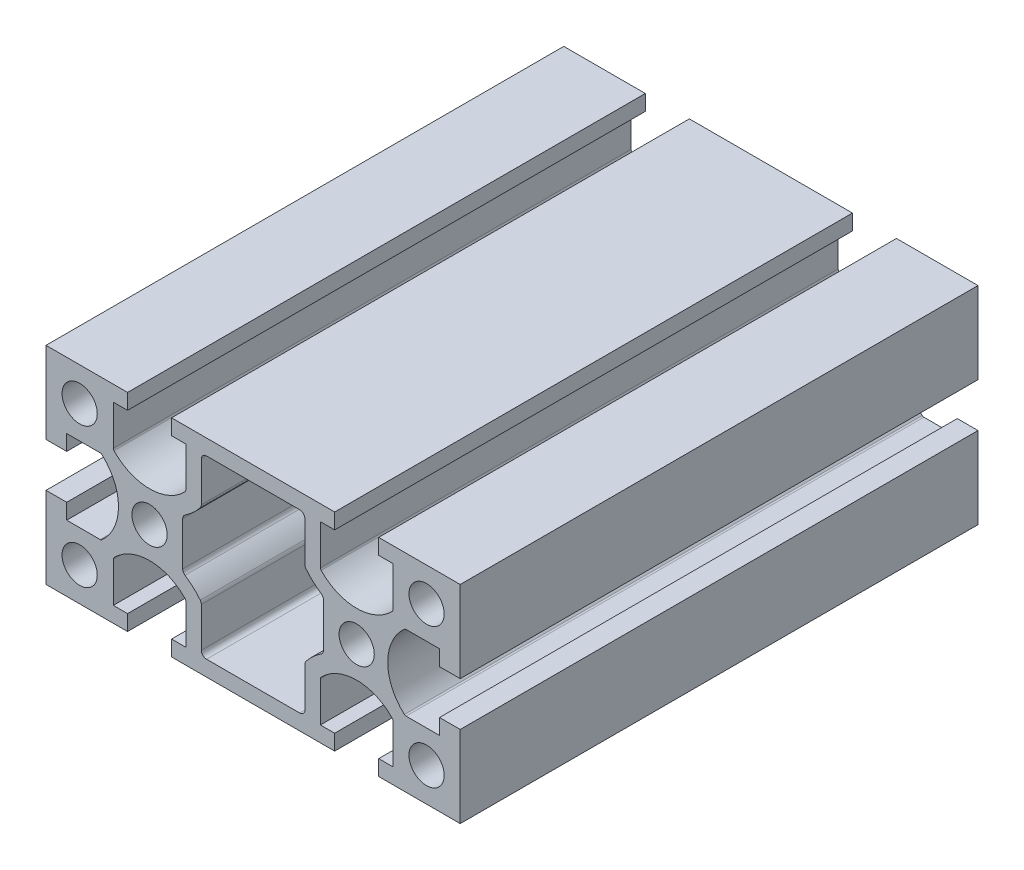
SolidWorks part; units mm, degrees
ref_plane "前基準面" through (0, 0, 0) normal (0, 0, 1) x (1, 0, 0)
ref_plane "上基準面" through (0, 0, 0) normal (0, 1, 0) x (1, 0, 0)
ref_plane "右基準面" through (0, 0, 0) normal (1, 0, 0) x (0, 0, -1)
sketch "草圖1" plane through (0, 0, 0) normal (0, 0, 1) x (1, 0, 0)
  line L0 (0, 53.2301) -> (0, -51.0629) construction
  line L2 (-40, 20) -> (40, 20)
  line L3 (-40, 20) -> (-40, -20)
  line L4 (-40, -20) -> (40, -20)
  line L5 (40, 20) -> (40, -20)
  line L6 (-40, 20) -> (40, -20) construction
  line L7 (-40, -20) -> (40, 20) construction
  point P3 (0, 0)
  dimension "D1" = 80
  dimension "D2" = 40
extrude "填料-伸長1" add sketch "草圖1" along normal mid plane 100
sketch "草圖2" plane through (0, 0, 50) normal (0, 0, 1) x (1, 0, 0)
  circle A0 centre (-20, 0) radius 3.4
  circle A1 centre (20, 0) radius 3.4
  dimension "D1" = 40
  dimension "D3" = 6.8
  dimension "D2" = 20
extrude "除料-伸長1" cut sketch "草圖2" against normal through all
sketch "草圖3" plane through (0, 0, 50) normal (0, 0, 1) x (1, 0, 0)
  line L0 (-33.5, 13.5) -> (33.5, 13.5) construction
  circle A0 centre (-33.5, 13.5) radius 3.4
  circle A2 centre (33.5, 13.5) radius 3.4
  circle A3 centre (33.5, -13.5) radius 3.4
  circle A4 centre (-33.5, -13.5) radius 3.4
  dimension "D2" = 6.8
  dimension "D1" = 33.5
  dimension "D3" = 13.5
  dimension "D5" = 67
  dimension "D4" = 2
extrude "除料-伸長2" cut sketch "草圖3" against normal through all
sketch "草圖4" plane through (0, 0, 50) normal (0, 0, 1) x (1, 0, 0)
  line L0 (20, 20) -> (20, 10) construction
  line L1 (40, 20) -> (-40, 20) construction
  line L2 (40, 20) -> (20, 20) construction
  line L3 (15.75, 20) -> (24.25, 20)
  line L4 (13, 17) -> (13, 9.2751)
  line L5 (15.75, 17) -> (13, 17)
  line L6 (15.75, 20) -> (15.75, 17)
  line L10 (24.25, 20) -> (24.25, 17)
  line L11 (27, 17) -> (27, 9.2751)
  line L15 (24.25, 17) -> (27, 17)
  arc A0 (26.8611, 8.9292) -> (27, 9.2751) centre (26.5, 9.2751) ccw
  arc A1 (13, 9.2751) -> (13.1389, 8.9292) centre (13.5, 9.2751) ccw
  arc A3 (13.1389, 8.9292) -> (26.8611, 8.9292) centre (20, 15.5) ccw
  point P10 (27, 9.0774)
  point P14 (13, 9.0774)
  dimension "D1" = 20
  dimension "D6" = 9.5
  dimension "D4" = 8.5
  dimension "D5" = 3
  dimension "D7" = 4.5
  dimension "D2" = 0.5
  dimension "D3" = 14
extrude "除料-伸長3" cut sketch "草圖4" against normal through all
mirror "鏡射1" about plane through (0, 0, 0) normal (0, 1, 0) of "除料-伸長3"
pattern_linear "直線複製排列1" count 2 spacing 40 along (-1, 0, 0) of "鏡射1", "除料-伸長3"
sketch "草圖5" plane through (0, 0, 50) normal (0, 0, 1) x (1, 0, 0)
  line L0 (0, 0) -> (-40, 0) construction
  line L1 (-40, 20) -> (-40, -20) construction
  line L2 (-40, -4.25) -> (-40, 4.25)
  line L3 (-40, 4.25) -> (-36, 4.25)
  line L4 (-36, 4.25) -> (-36, 7.25)
  line L5 (-36, 7.25) -> (-29.5471, 7.25)
  line L6 (-40, -4.25) -> (-36, -4.25)
  line L7 (-36, -4.25) -> (-36, -7.25)
  line L8 (-36, -7.25) -> (-29.5471, -7.25)
  arc A0 (-29.2163, -7.125) -> (-29.2163, 7.125) centre (-35.5, 0) ccw
  arc A1 (-29.5471, 7.25) -> (-29.2163, 7.125) centre (-29.5471, 6.75) cw
  arc A2 (-29.5471, -7.25) -> (-29.2163, -7.125) centre (-29.5471, -6.75) ccw
  dimension "D4" = 9.5
  dimension "D5" = 0.5
  dimension "D1" = 4
  dimension "D2" = 8.5
  dimension "D3" = 14.5
  dimension "D6" = 4.5
extrude "除料-伸長4" cut sketch "草圖5" against normal through all
mirror "鏡射2" about plane through (0, 0, 0) normal (1, 0, 0) of "除料-伸長4"
sketch "草圖7" plane through (0, 0, 50) normal (0, 0, 1) x (1, 0, 0)
  line L0 (-9, 17) -> (9, 17)
  line L1 (10, 16) -> (10, 8.3411)
  line L2 (-13.6, 0) -> (13.6, 0) construction
  line L3 (13.6, 4.2089) -> (13.6, -4.2089)
  line L4 (0, -17) -> (0, 17) construction
  line L5 (15.75, 17) -> (13, 17) construction
  line L6 (13, 17) -> (13, 9.2751) construction
  line L7 (-13.6, 4.2089) -> (-13.6, -4.2089)
  line L8 (-10, 16) -> (-10, 8.3411)
  line L9 (-10, -16) -> (-10, -8.3411)
  line L10 (10, -16) -> (10, -8.3411)
  line L11 (-9, -17) -> (9, -17)
  circle A0 centre (20, 0) radius 3.4 construction
  arc A2 (13.1389, 8.9292) -> (26.8611, 8.9292) centre (20, 15.5) ccw construction
  arc A3 (-10.2174, 7.7186) -> (-13.1481, 5.0452) centre (-20, 15.5) cw
  arc A4 (10.2174, 7.7186) -> (13.1481, 5.0452) centre (20, 15.5) ccw
  arc A5 (10.2174, -7.7186) -> (13.1481, -5.0452) centre (20, -15.5) cw
  arc A6 (-10.2174, -7.7186) -> (-13.1481, -5.0452) centre (-20, -15.5) ccw
  arc A7 (-10, 16) -> (-9, 17) centre (-9, 16) cw
  arc A8 (-10.2174, 7.7186) -> (-10, 8.3411) centre (-11, 8.3411) ccw
  arc A9 (-13.1481, 5.0452) -> (-13.6, 4.2089) centre (-12.6, 4.2089) ccw
  arc A10 (-13.1481, -5.0452) -> (-13.6, -4.2089) centre (-12.6, -4.2089) cw
  arc A11 (-10.2174, -7.7186) -> (-10, -8.3411) centre (-11, -8.3411) cw
  arc A12 (-10, -16) -> (-9, -17) centre (-9, -16) ccw
  arc A13 (10, -16) -> (9, -17) centre (9, -16) cw
  arc A14 (10.2174, -7.7186) -> (10, -8.3411) centre (11, -8.3411) ccw
  arc A15 (13.1481, -5.0452) -> (13.6, -4.2089) centre (12.6, -4.2089) ccw
  arc A16 (13.6, 4.2089) -> (13.1481, 5.0452) centre (12.6, 4.2089) ccw
  arc A17 (10, 8.3411) -> (10.2174, 7.7186) centre (11, 8.3411) ccw
  arc A18 (9, 17) -> (10, 16) centre (9, 16) cw
  point P23 (0, 0)
  point P33 (-10, 17)
  point P36 (-10, 8)
  point P39 (-13.6, 4.7627)
  point P42 (-13.6, -4.7627)
  point P45 (-10, -8)
  point P48 (-10, -17)
  point P51 (10, -17)
  point P54 (10, -8)
  point P57 (13.6, -4.7627)
  point P60 (13.6, 4.7627)
  point P63 (10, 8)
  point P66 (10, 17)
  dimension "D3" = 3
  dimension "D4" = 1
  dimension "D1" = 3
  dimension "D2" = 6.4
extrude "除料-伸長5" cut sketch "草圖7" against normal through all
